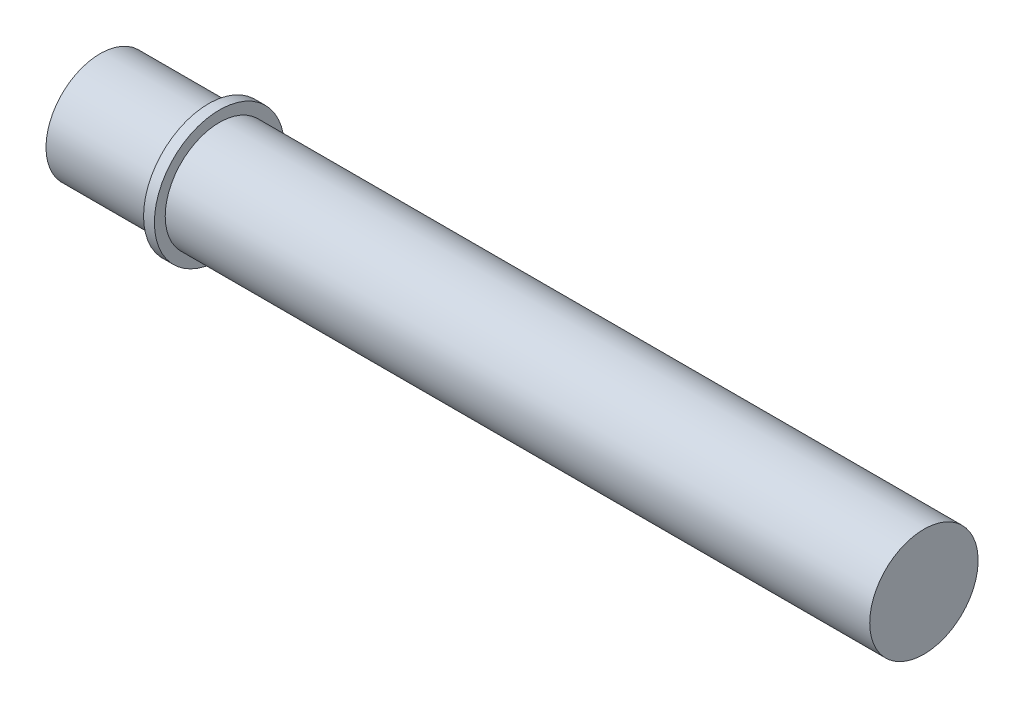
SolidWorks part; units mm, degrees
ref_plane "Face" through (0, 0, 0) normal (0, 0, 1) x (1, 0, 0)
ref_plane "Dessus" through (0, 0, 0) normal (0, 1, 0) x (1, 0, 0)
ref_plane "Droite" through (0, 0, 0) normal (1, 0, 0) x (0, 0, -1)
sketch "Esquisse1" plane through (0, 0, 0) normal (0, 0, 1) x (1, 0, 0)
  line L0 (0, 0) -> (56.582, 0) construction
  line L1 (0, 0) -> (0, 5)
  line L2 (0, 5) -> (10, 5)
  line L3 (10, 5) -> (10, 6)
  line L4 (10, 6) -> (11, 6)
  line L5 (11, 6) -> (11, 5)
  line L6 (11, 5) -> (76, 5)
  line L7 (76, 5) -> (76, 0)
  line L8 (0, 0) -> (76, 0)
  dimension "D1" = 10
  dimension "D2" = 65
  dimension "D3" = 1
  dimension "D4" = 5
  dimension "D5" = 6
revolve "Base-Révolution" add sketch "Esquisse1" angle 360 about L0
